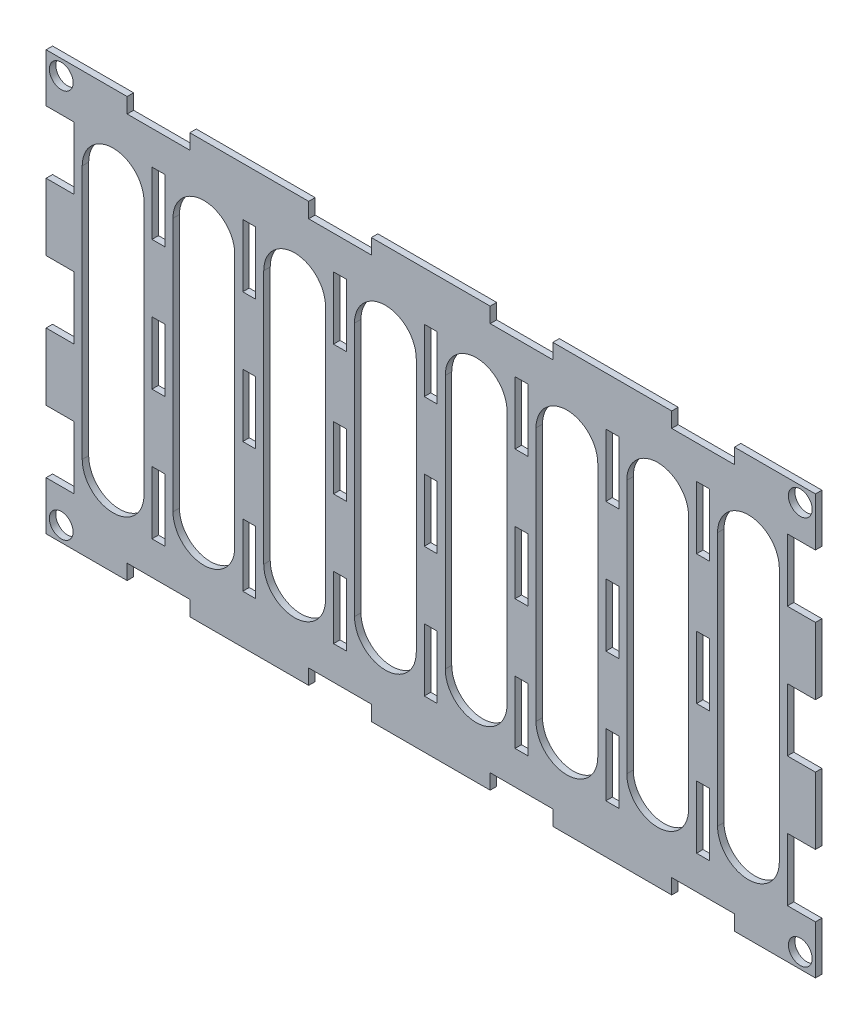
SolidWorks part; units mm, degrees
ref_plane "Front Plane" through (0, 0, 0) normal (0, 0, 1) x (1, 0, 0)
ref_plane "Top Plane" through (0, 0, 0) normal (0, 1, 0) x (1, 0, 0)
ref_plane "Right Plane" through (0, 0, 0) normal (1, 0, 0) x (0, 0, -1)
sketch "Sketch1" plane through (0, 0, 0) normal (0, 0, 1) x (1, 0, 0)
  line L0 (31, 155.82) -> (31, 38.18) construction
  line L1 (0, 0) -> (356, 0)
  line L2 (0, 0) -> (0, 194)
  line L3 (0, 194) -> (356, 194)
  line L4 (356, 0) -> (356, 194)
  line L5 (45.29, 155.82) -> (45.29, 38.18)
  line L6 (16.71, 155.82) -> (16.71, 38.18)
  line L7 (0, 97) -> (7, 97) construction
  line L8 (7, 104.25) -> (0, 104.25) construction
  line L9 (73, 155.82) -> (73, 38.18) construction
  line L10 (87.29, 155.82) -> (87.29, 38.18)
  line L11 (58.71, 155.82) -> (58.71, 38.18)
  line L12 (115, 155.82) -> (115, 38.18) construction
  line L13 (129.29, 155.82) -> (129.29, 38.18)
  line L14 (100.71, 155.82) -> (100.71, 38.18)
  line L15 (157, 155.82) -> (157, 38.18) construction
  line L16 (171.29, 155.82) -> (171.29, 38.18)
  line L17 (142.71, 155.82) -> (142.71, 38.18)
  line L18 (199, 155.82) -> (199, 38.18) construction
  line L19 (213.29, 155.82) -> (213.29, 38.18)
  line L20 (184.71, 155.82) -> (184.71, 38.18)
  line L21 (241, 155.82) -> (241, 38.18) construction
  line L22 (255.29, 155.82) -> (255.29, 38.18)
  line L23 (226.71, 155.82) -> (226.71, 38.18)
  line L24 (283, 155.82) -> (283, 38.18) construction
  line L25 (297.29, 155.82) -> (297.29, 38.18)
  line L26 (268.71, 155.82) -> (268.71, 38.18)
  line L27 (325, 155.82) -> (325, 38.18) construction
  line L28 (339.29, 155.82) -> (339.29, 38.18)
  line L29 (310.71, 155.82) -> (310.71, 38.18)
  line L31 (7, 97) -> (7, 111.5)
  line L32 (7, 111.5) -> (13, 111.5)
  line L33 (13, 82.5) -> (13, 111.5)
  line L34 (13, 142.5) -> (7, 142.5)
  line L35 (13, 142.5) -> (13, 171.5)
  line L36 (13, 171.5) -> (7, 171.5)
  line L37 (7, 142.5) -> (7, 171.5)
  line L38 (13, 97) -> (356, 97) construction
  line L39 (13, 22.5) -> (7, 22.5)
  line L40 (7, 51.5) -> (7, 22.5)
  line L41 (13, 51.5) -> (13, 22.5)
  line L42 (13, 51.5) -> (7, 51.5)
  line L43 (7, 82.5) -> (13, 82.5)
  line L44 (7, 97) -> (7, 82.5)
  line L45 (55, 142.5) -> (55, 171.5)
  line L46 (49, 142.5) -> (49, 171.5)
  line L47 (55, 171.5) -> (49, 171.5)
  line L48 (55, 142.5) -> (49, 142.5)
  line L49 (55, 82.5) -> (55, 111.5)
  line L50 (49, 97) -> (49, 111.5)
  line L51 (49, 111.5) -> (55, 111.5)
  line L52 (49, 97) -> (49, 82.5)
  line L53 (49, 82.5) -> (55, 82.5)
  line L54 (49, 51.5) -> (49, 22.5)
  line L55 (55, 51.5) -> (49, 51.5)
  line L56 (55, 51.5) -> (55, 22.5)
  line L57 (55, 22.5) -> (49, 22.5)
  line L58 (97, 142.5) -> (97, 171.5)
  line L59 (91, 142.5) -> (91, 171.5)
  line L60 (97, 171.5) -> (91, 171.5)
  line L61 (97, 142.5) -> (91, 142.5)
  line L62 (97, 82.5) -> (97, 111.5)
  line L63 (91, 97) -> (91, 111.5)
  line L64 (91, 111.5) -> (97, 111.5)
  line L65 (91, 97) -> (91, 82.5)
  line L66 (91, 82.5) -> (97, 82.5)
  line L67 (91, 51.5) -> (91, 22.5)
  line L68 (97, 51.5) -> (91, 51.5)
  line L69 (97, 51.5) -> (97, 22.5)
  line L70 (97, 22.5) -> (91, 22.5)
  line L71 (139, 142.5) -> (139, 171.5)
  line L72 (133, 142.5) -> (133, 171.5)
  line L73 (139, 171.5) -> (133, 171.5)
  line L74 (139, 142.5) -> (133, 142.5)
  line L75 (139, 82.5) -> (139, 111.5)
  line L76 (133, 97) -> (133, 111.5)
  line L77 (133, 111.5) -> (139, 111.5)
  line L78 (133, 97) -> (133, 82.5)
  line L79 (133, 82.5) -> (139, 82.5)
  line L80 (133, 51.5) -> (133, 22.5)
  line L81 (139, 51.5) -> (133, 51.5)
  line L82 (139, 51.5) -> (139, 22.5)
  line L83 (139, 22.5) -> (133, 22.5)
  line L84 (181, 142.5) -> (181, 171.5)
  line L85 (175, 142.5) -> (175, 171.5)
  line L86 (181, 171.5) -> (175, 171.5)
  line L87 (181, 142.5) -> (175, 142.5)
  line L88 (181, 82.5) -> (181, 111.5)
  line L89 (175, 97) -> (175, 111.5)
  line L90 (175, 111.5) -> (181, 111.5)
  line L91 (175, 97) -> (175, 82.5)
  line L92 (175, 82.5) -> (181, 82.5)
  line L93 (175, 51.5) -> (175, 22.5)
  line L94 (181, 51.5) -> (175, 51.5)
  line L95 (181, 51.5) -> (181, 22.5)
  line L96 (181, 22.5) -> (175, 22.5)
  line L97 (223, 142.5) -> (223, 171.5)
  line L98 (217, 142.5) -> (217, 171.5)
  line L99 (223, 171.5) -> (217, 171.5)
  line L100 (223, 142.5) -> (217, 142.5)
  line L101 (223, 82.5) -> (223, 111.5)
  line L102 (217, 97) -> (217, 111.5)
  line L103 (217, 111.5) -> (223, 111.5)
  line L104 (217, 97) -> (217, 82.5)
  line L105 (217, 82.5) -> (223, 82.5)
  line L106 (217, 51.5) -> (217, 22.5)
  line L107 (223, 51.5) -> (217, 51.5)
  line L108 (223, 51.5) -> (223, 22.5)
  line L109 (223, 22.5) -> (217, 22.5)
  line L110 (265, 142.5) -> (265, 171.5)
  line L111 (259, 142.5) -> (259, 171.5)
  line L112 (265, 171.5) -> (259, 171.5)
  line L113 (265, 142.5) -> (259, 142.5)
  line L114 (265, 82.5) -> (265, 111.5)
  line L115 (259, 97) -> (259, 111.5)
  line L116 (259, 111.5) -> (265, 111.5)
  line L117 (259, 97) -> (259, 82.5)
  line L118 (259, 82.5) -> (265, 82.5)
  line L119 (259, 51.5) -> (259, 22.5)
  line L120 (265, 51.5) -> (259, 51.5)
  line L121 (265, 51.5) -> (265, 22.5)
  line L122 (265, 22.5) -> (259, 22.5)
  line L123 (307, 142.5) -> (307, 171.5)
  line L124 (301, 142.5) -> (301, 171.5)
  line L125 (307, 171.5) -> (301, 171.5)
  line L126 (307, 142.5) -> (301, 142.5)
  line L127 (307, 82.5) -> (307, 111.5)
  line L128 (301, 97) -> (301, 111.5)
  line L129 (301, 111.5) -> (307, 111.5)
  line L130 (301, 97) -> (301, 82.5)
  line L131 (301, 82.5) -> (307, 82.5)
  line L132 (301, 51.5) -> (301, 22.5)
  line L133 (307, 51.5) -> (301, 51.5)
  line L134 (307, 51.5) -> (307, 22.5)
  line L135 (307, 22.5) -> (301, 22.5)
  line L136 (349, 142.5) -> (349, 171.5)
  line L137 (343, 142.5) -> (343, 171.5)
  line L138 (349, 171.5) -> (343, 171.5)
  line L139 (349, 142.5) -> (343, 142.5)
  line L140 (349, 82.5) -> (349, 111.5)
  line L141 (343, 97) -> (343, 111.5)
  line L142 (343, 111.5) -> (349, 111.5)
  line L143 (343, 97) -> (343, 82.5)
  line L144 (343, 82.5) -> (349, 82.5)
  line L145 (343, 51.5) -> (343, 22.5)
  line L146 (349, 51.5) -> (343, 51.5)
  line L147 (349, 51.5) -> (349, 22.5)
  line L148 (349, 22.5) -> (343, 22.5)
  line L149 (49, 142.5) -> (45.29, 142.5) construction
  line L150 (55, 142.5) -> (58.71, 142.5) construction
  line L151 (52, 171.5) -> (52, 194) construction
  line L152 (66.5, 0) -> (66.5, 7)
  line L153 (37.5, 194) -> (66.5, 194)
  line L154 (37.5, 194) -> (37.5, 187)
  line L155 (37.5, 187) -> (66.5, 187)
  line L156 (66.5, 194) -> (66.5, 187)
  line L157 (37.5, 7) -> (66.5, 7)
  line L158 (37.5, 0) -> (37.5, 7)
  line L159 (121.5, 194) -> (121.5, 187)
  line L160 (121.5, 187) -> (150.5, 187)
  line L161 (150.5, 194) -> (150.5, 187)
  line L162 (121.5, 7) -> (150.5, 7)
  line L163 (121.5, 0) -> (121.5, 7)
  line L164 (150.5, 0) -> (150.5, 7)
  line L165 (205.5, 194) -> (205.5, 187)
  line L166 (205.5, 187) -> (234.5, 187)
  line L167 (234.5, 194) -> (234.5, 187)
  line L168 (205.5, 7) -> (234.5, 7)
  line L169 (205.5, 0) -> (205.5, 7)
  line L170 (234.5, 0) -> (234.5, 7)
  line L171 (289.5, 194) -> (289.5, 187)
  line L172 (289.5, 187) -> (318.5, 187)
  line L173 (318.5, 194) -> (318.5, 187)
  line L174 (289.5, 7) -> (318.5, 7)
  line L175 (289.5, 0) -> (289.5, 7)
  line L176 (318.5, 0) -> (318.5, 7)
  line L177 (349, 171.5) -> (356, 171.5)
  line L178 (349, 142.5) -> (356, 142.5)
  line L179 (349, 111.5) -> (356, 111.5)
  line L180 (349, 82.5) -> (356, 82.5)
  line L181 (349, 51.5) -> (356, 51.5)
  line L182 (349, 22.5) -> (356, 22.5)
  line L183 (7, 22.5) -> (0, 22.5)
  line L184 (7, 51.5) -> (0, 51.5)
  line L185 (7, 82.5) -> (0, 82.5)
  line L186 (7, 111.5) -> (0, 111.5)
  line L187 (7, 142.5) -> (0, 142.5)
  line L188 (7, 171.5) -> (0, 171.5)
  arc A0 (45.29, 155.82) -> (16.71, 155.82) centre (31, 155.82) ccw
  arc A1 (16.71, 38.18) -> (45.29, 38.18) centre (31, 38.18) ccw
  arc A2 (87.29, 155.82) -> (58.71, 155.82) centre (73, 155.82) ccw
  arc A3 (58.71, 38.18) -> (87.29, 38.18) centre (73, 38.18) ccw
  arc A4 (129.29, 155.82) -> (100.71, 155.82) centre (115, 155.82) ccw
  arc A5 (100.71, 38.18) -> (129.29, 38.18) centre (115, 38.18) ccw
  arc A6 (171.29, 155.82) -> (142.71, 155.82) centre (157, 155.82) ccw
  arc A7 (142.71, 38.18) -> (171.29, 38.18) centre (157, 38.18) ccw
  arc A8 (213.29, 155.82) -> (184.71, 155.82) centre (199, 155.82) ccw
  arc A9 (184.71, 38.18) -> (213.29, 38.18) centre (199, 38.18) ccw
  arc A10 (255.29, 155.82) -> (226.71, 155.82) centre (241, 155.82) ccw
  arc A11 (226.71, 38.18) -> (255.29, 38.18) centre (241, 38.18) ccw
  arc A12 (297.29, 155.82) -> (268.71, 155.82) centre (283, 155.82) ccw
  arc A13 (268.71, 38.18) -> (297.29, 38.18) centre (283, 38.18) ccw
  arc A14 (339.29, 155.82) -> (310.71, 155.82) centre (325, 155.82) ccw
  arc A15 (310.71, 38.18) -> (339.29, 38.18) centre (325, 38.18) ccw
  point P7 (31, 97)
  point P19 (73, 97)
  point P26 (115, 97)
  point P33 (157, 97)
  point P40 (199, 97)
  point P47 (241, 97)
  point P54 (283, 97)
  point P61 (325, 97)
  point P193 (52, 187)
extrude "Boss-Extrude1" add sketch "Sketch1" along normal blind 3 contours L176 L1 L4 L3 L173 L172 L171 L167 L166 L165 L161 L160 L159 L156 L155 L154 L2 L158 L157 L152 L163 L162 L164 L169 L168 L170 L175 L174 A15 L29 A14 L28 A13 L26 A12 L25 A11 L23 A10 L22
sketch "Sketch2" plane through (0, 0, 3) normal (0, 0, 1) x (1, 0, 0)
  line L0 (0, 171.5) -> (0, 194) construction
  line L1 (0, 194) -> (37.5, 194) construction
  line L2 (178, 194) -> (178, -79.9551) construction
  line L3 (150.5, 194) -> (205.5, 194) construction
  line L5 (13, 82.5) -> (13, 111.5) construction
  line L6 (13, 97) -> (486.5546, 97) construction
  circle A0 centre (7, 187) radius 5.5
  circle A1 centre (349, 187) radius 5.5
  circle A2 centre (349, 7) radius 5.5
  circle A3 centre (7, 7) radius 5.5
  dimension "D1" = 11
  dimension "D2" = 7
  dimension "D3" = 7
extrude "Cut-Extrude1" cut sketch "Sketch2" against normal blind 10
equation "\"sheetThickness\"=0.63mm"
equation "\"flange\"= 11mm"
equation "\"baffleCutWidth\"= 28.58mm"
equation "\"baffleCutLength\"= 146.22mm"
equation "\"metalLength\" = 156.28mm"
equation "\"metalWidth\" = 35.5mm"
equation "\"D1@Sketch1\"= \"baffleCutLength\" - \"baffleCutWidth\""
equation "\"test\"= 99mm"
equation "\"pitch\" = 42mm"
equation "\"D2@Sketch1\"=\"baffleCutWidth\""
equation "\"D12@Sketch1\"=\"pitch\""
equation "\"D17@Sketch1\"=2*\"pitch\""
equation "\"D7@Sketch1\"=\"pitch\""
equation "\"D4@Sketch1\"=29/2"
